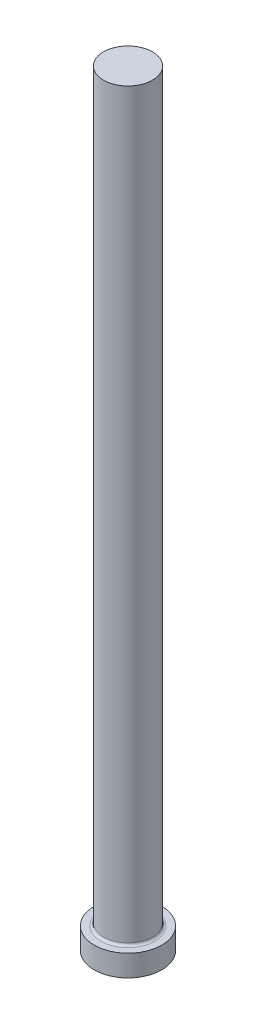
SolidWorks part; units mm, degrees
ref_plane "Plano frontal" through (0, 0, 0) normal (0, 0, 1) x (1, 0, 0)
ref_plane "Plano superior" through (0, 0, 0) normal (0, 1, 0) x (1, 0, 0)
ref_plane "Plano direito" through (0, 0, 0) normal (1, 0, 0) x (0, 0, -1)
sketch "Esboço1" plane through (0, 0, 0) normal (0, 0, 1) x (1, 0, 0)
  line L0 (0, 0) -> (11, 0)
  line L1 (11, 0) -> (11, 7)
  line L2 (11, 7) -> (8.8, 7)
  line L3 (8, 7.8) -> (8, 250)
  line L4 (8, 250) -> (0, 250)
  line L5 (0, 250) -> (0, 0) construction
  line L6 (0, 0) -> (0, 250)
  arc A0 (8.8, 7) -> (8, 7.8) centre (8.8, 7.8) cw
  dimension "D3" = 0.8
  dimension "D1" = 22
  dimension "D2" = 16
  dimension "D4" = 7
  dimension "D5" = 250
revolve "Revolução1" add sketch "Esboço1" angle 360 about L5
sketch "Esboço2"
  dimension "D1" = 0.825
  dimension "D2" = 1.925
  dimension "D3" = 1.2375
  dimension "D4" = 5.9125
wrap "Envolver1" sketch "Esboço2" wrap type deboss source sketch "Esboço2" thickness 0.1 parameters "D1"=0.1
